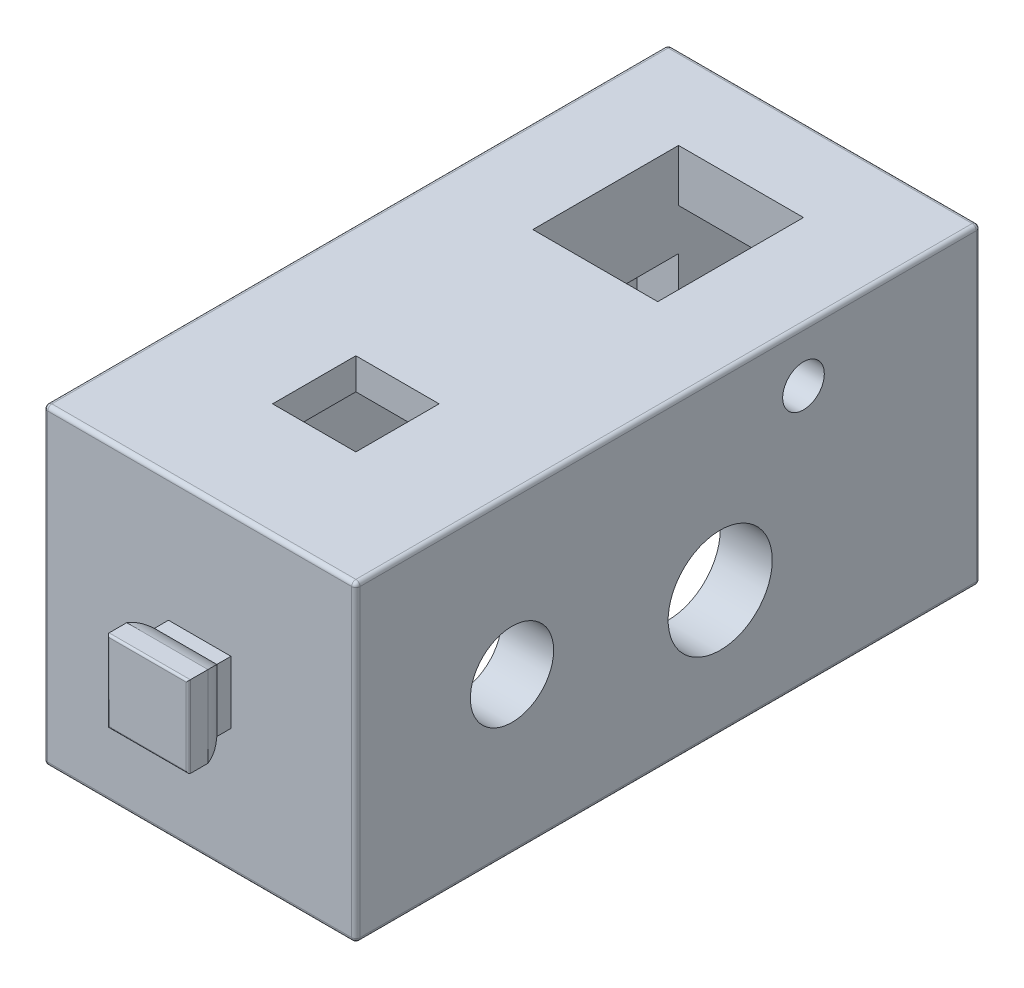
SolidWorks part; units mm, degrees
ref_plane "前视基准面" through (0, 0, 0) normal (0, 0, 1) x (1, 0, 0)
ref_plane "上视基准面" through (0, 0, 0) normal (0, 1, 0) x (1, 0, 0)
ref_plane "右视基准面" through (0, 0, 0) normal (1, 0, 0) x (0, 0, -1)
sketch "草图1" plane through (0, 0, 0) normal (0, 0, 1) x (1, 0, 0)
  line L1 (-7.5, 0) -> (7.5, 0)
  line L2 (-7.5, 0) -> (-7.5, 15)
  line L3 (-7.5, 15) -> (7.5, 15)
  line L4 (7.5, 0) -> (7.5, 15)
extrude "凸台-拉伸1" add sketch "草图1" against normal blind 30
sketch "草图2" plane through (0, 0, 0) normal (0, 0, 1) x (1, 0, 0)
  line L1 (-1.5, 6) -> (1.5, 6)
  line L2 (-1.5, 6) -> (-1.5, 9)
  line L3 (-1.5, 9) -> (1.5, 9)
  line L4 (1.5, 6) -> (1.5, 9)
extrude "凸台-拉伸2" add sketch "草图2" along normal blind 1
sketch "草图3" plane through (0, 6, 0) normal (0, -1, 0) x (1, 0, 0)
  line L0 (-1.95, 2.5) -> (1.95, 2.5)
  line L1 (-1.95, 2.5) -> (-1.95, 1.5556)
  line L2 (1.95, 2.5) -> (1.95, 1.5556)
  line L4 (-1.5, 0.6771) -> (1.5, 0.6771)
  arc A1 (-1.95, 1.5556) -> (-1.5, 0.6771) centre (0, 2) ccw
  arc A2 (1.5, 0.6771) -> (1.95, 1.5556) centre (0, 2) ccw
extrude "凸台-拉伸3" add sketch "草图3" along normal blind 1 and the other way blind 4
sketch "草图4" plane through (-1.95, 0, 0) normal (-1, 0, 0) x (0, 0, 1)
  line L2 (2.5, 9.45) -> (1.5556, 9.45)
  line L3 (2.5, 5.55) -> (1.5556, 5.55)
  line L5 (2.5, 5.55) -> (2.5, 5)
  line L6 (2.5, 5) -> (0.6771, 5)
  line L7 (0.6771, 5) -> (0.6771, 6)
  line L8 (0.6771, 9) -> (0.6771, 10)
  line L9 (0.6771, 10) -> (2.5, 10)
  line L10 (2.5, 10) -> (2.5, 9.45)
  arc A1 (0.6771, 6) -> (1.5556, 5.55) centre (2, 7.5) ccw
  arc A2 (1.5556, 9.45) -> (0.6771, 9) centre (2, 7.5) ccw
extrude "切除-拉伸1" cut sketch "草图4" against normal up to next
fillet "圆角1" radius 0.1 4 edges at (-1.95, 7.5, 2.5) (0, 9.45, 2.5) (1.95, 7.5, 2.5) (0, 5.55, 2.5)
sketch "草图5" plane through (0, 0, 0) normal (0, -1, 0) x (1, 0, 0)
  line L0 (-7.5, -30) -> (7.5, -30) construction
  line L1 (-5, -1.5) -> (5, -1.5)
  line L2 (-5, -1.5) -> (-5, -26)
  line L3 (-5, -26) -> (-3, -26)
  line L4 (5, -1.5) -> (5, -26)
  line L6 (-3, -26) -> (-3, -30)
  line L7 (-3, -30) -> (3, -30)
  line L8 (3, -26) -> (3, -30)
  line L9 (3, -26) -> (5, -26)
extrude "切除-拉伸2" cut sketch "草图5" against normal blind 13.5
sketch "草图6" plane through (0, 13.5, 0) normal (0, -1, 0) x (1, 0, 0)
  line L0 (-5, -1.5) -> (-5, -26) construction
  line L1 (-5, -17.5) -> (5, -17.5)
  line L2 (-5, -17.5) -> (-5, -26)
  line L3 (-5, -26) -> (5, -26)
  line L4 (5, -17.5) -> (5, -26)
extrude "凸台-拉伸4" add sketch "草图6" along normal blind 3
sketch "草图7" plane through (0, 13.5, 0) normal (0, -1, 0) x (1, 0, 0)
  line L1 (-3, -30) -> (3, -30)
  line L2 (-3, -30) -> (-3, -26)
  line L3 (-3, -26) -> (3, -26)
  line L4 (3, -30) -> (3, -26)
extrude "凸台-拉伸5" add sketch "草图7" along normal blind 1
sketch "草图8" plane through (0, 10.5, 0) normal (0, -1, 0) x (1, 0, 0)
  line L1 (-3, -19) -> (3, -19)
  line L2 (-3, -19) -> (-3, -26)
  line L3 (-3, -26) -> (3, -26)
  line L4 (3, -19) -> (3, -26)
extrude "切除-拉伸3" cut sketch "草图8" against normal through all
sketch "草图10" plane through (0, 0, 0) normal (0, -1, 0) x (1, 0, 0)
  line L0 (-5.75, -30) -> (-5.75, -29.3614)
  line L1 (-7.5, -30) -> (-3, -30) construction
  line L2 (-4.25, -30) -> (-4.25, -29.3614)
  line L3 (-5.75, -30) -> (-4.25, -30)
  line L4 (0, -30.6198) -> (0, -25.6256) construction
  line L5 (5.75, -30) -> (4.25, -30)
  line L6 (4.25, -30) -> (4.25, -29.3614)
  line L7 (5.75, -30) -> (5.75, -29.3614)
  arc A0 (-4.25, -29.3614) -> (-5.75, -29.3614) centre (-5, -28.7) ccw
  arc A1 (4.25, -29.3614) -> (5.75, -29.3614) centre (5, -28.7) cw
extrude "切除-拉伸4" cut sketch "草图10" against normal blind 13.5
sketch "草图11" plane through (0, 15, 0) normal (0, 1, 0) x (-1, 0, 0)
  line L1 (2, -5.5) -> (-2, -5.5)
  line L2 (2, -5.5) -> (2, -9.5)
  line L3 (2, -9.5) -> (-2, -9.5)
  line L4 (-2, -5.5) -> (-2, -9.5)
extrude "切除-拉伸5" cut sketch "草图11" against normal up to next
sketch "草图12" plane through (7.5, 0, 0) normal (1, 0, 0) x (0, 0, -1)
  circle A0 centre (17.5, 6) radius 2.5
  circle A1 centre (7.5, 7.5) radius 2
  circle A2 centre (21.5, 12.5) radius 1
extrude "切除-拉伸6" cut sketch "草图12" against normal up to next
sketch "草图14" plane through (-5, 0, 0) normal (1, 0, 0) x (0, 0, -1)
  circle A0 centre (7.5, 7.5) radius 2
  circle A1 centre (21.5, 12.5) radius 1
  circle A2 centre (17.5, 6) radius 1.25
extrude "切除-拉伸7" cut sketch "草图14" against normal up to next
fillet "圆角2" radius 0.2 19 edges at (-6.625, 0, -30) (-3.625, 0, -30) (3.625, 0, -30) (6.625, 0, -30) (-7.5, 0, -15) (-7.5, 7.5, -30) (-7.5, 7.5, 0) (0, 0, 0) (7.5, 0, -15) (7.5, 7.5, -30) (0, 15, -30) (-7.5, 15, -15) (7.5, 7.5, 0) (7.5, 15, -15) (0, 15, 0) (-5.75, 6.75, -30) (-4.25, 6.75, -30) (4.25, 6.75, -30) (5.75, 6.75, -30)
